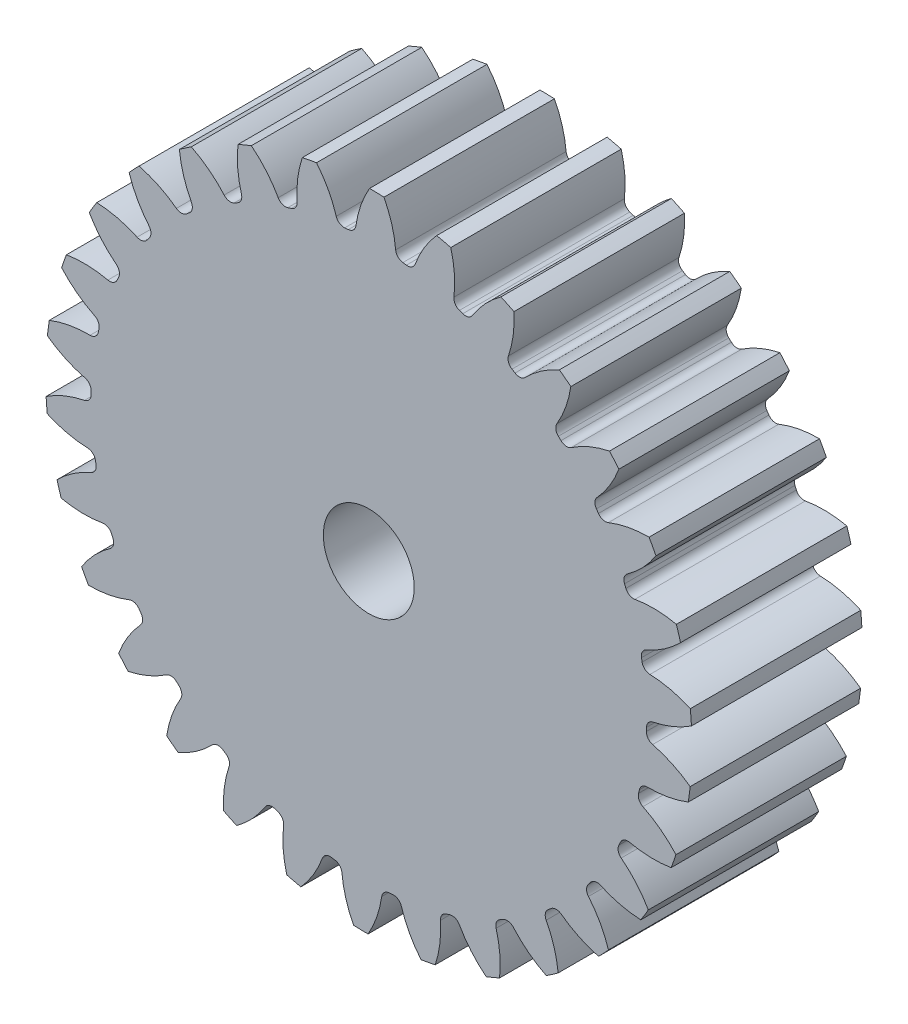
SolidWorks part; units mm, degrees
ref_plane "Front" through (0, 0, 0) normal (0, 0, 1) x (1, 0, 0)
ref_plane "Top" through (0, 0, 0) normal (0, 1, 0) x (1, 0, 0)
ref_plane "Right" through (0, 0, 0) normal (1, 0, 0) x (0, 0, -1)
sketch "Sketch3" plane through (0, 0, 0) normal (0, 0, 1) x (1, 0, 0)
  circle A0 centre (0, 0) radius 180.6222
  dimension "od" = 361.2444
extrude "gearBody" add sketch "Sketch3" along normal blind 95.25
sketch "Sketch2" plane through (0, 0, 0) normal (0, 0, 1) x (1, 0, 0)
  line L0 (0, 0) -> (147.0089, 60.8931) construction
  line L1 (179.8791, -19.5081) -> (0, 0) construction
  line L2 (0, 0) -> (36.3143, 0) construction
  line L3 (169.2692, 4.6597) -> (168.8336, -13) construction
  line L5 (169.0514, -4.1701) -> (0, 0) construction
  line L7 (0, 0) -> (159.1213, 0) construction
  arc A0 (159.1129, 1.6377) -> (158.8386, -9.4808) centre (0, 0) ccw construction
  arc A1 (180.3217, 10.4156) -> (179.5888, -19.2939) centre (0, 0) ccw construction
  arc A2 (169.2692, 4.6597) -> (168.8336, -13) centre (0, 0) ccw construction
  arc A3 (155.1472, -4.8263) -> (155.1964, -2.8292) centre (0, 0) ccw
  arc A4 (179.8791, -19.5081) -> (158.6161, -9.4243) centre (143.8277, -68.0674) ccw
  arc A5 (179.8791, -19.5081) -> (180.6222, 10.6153) centre (0, 0) ccw
  arc A6 (180.6222, 10.6153) -> (158.8878, 1.5921) centre (147.0089, 60.8931) cw
  arc A7 (155.1964, -2.8292) -> (158.8878, 1.5921) centre (159.7903, -2.913) cw
  arc A8 (158.6161, -9.4243) -> (155.1472, -4.8263) centre (159.7395, -4.9692) cw
  point P6 (180.6222, 10.6153)
  point P22 (179.8791, -19.5081)
  dimension "baseDia" = 318.2426
  dimension "od" = 361.2444
  dimension "pd" = 338.6667
  dimension "rd" = 310.4444
  dimension "rFillet" = 4.5946
  dimension "pointX" = 180.6222
  dimension "pointY" = 10.6153
  dimension "CTT" = 17.6597
  dimension "flankCenterAngle" = 22.5
extrude "toothCut" cut sketch "Sketch2" along normal through all
pattern_circular "CirPattern1" count 30 over 360 about axis through (0, 0, 0) along (0, 0, 1) of "toothCut"
sketch "hub1Dia" plane through (0, 0, 0) normal (0, 0, -1) x (-1, 0, 0)
  circle A0 centre (0, 0) radius 12.7
  dimension "hub1Dia" = 25.4
sketch "hub2Dia" plane through (0, 0, 95.25) normal (0, 0, 1) x (1, 0, 0)
  circle A0 centre (0, 0) radius 12.7
  dimension "hub2dia" = 25.4
sketch "boreDia" plane through (0, 0, 0) normal (0, 0, 1) x (1, 0, 0)
  circle A0 centre (0, 0) radius 25.4
  dimension "boreDia" = 50.8
extrude "bore" cut sketch "boreDia" against normal mid plane 25400
